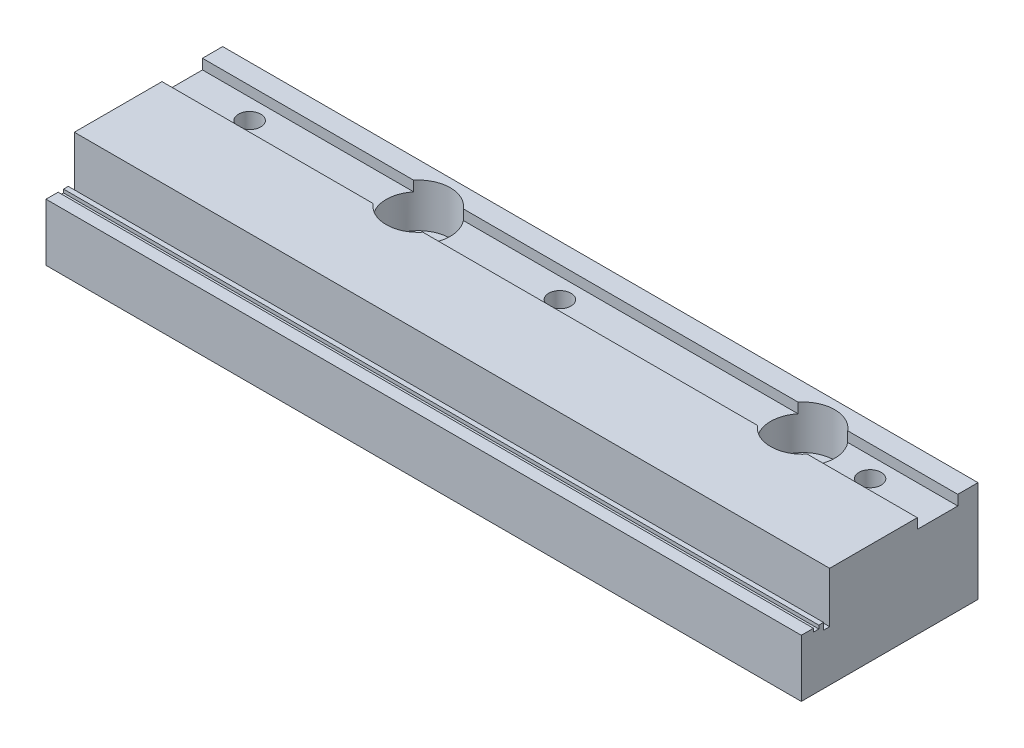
SolidWorks part; units mm, degrees
ref_plane "前视基准面" through (0, 0, 0) normal (0, 0, 1) x (1, 0, 0)
ref_plane "上视基准面" through (0, 0, 0) normal (0, 1, 0) x (1, 0, 0)
ref_plane "右视基准面" through (0, 0, 0) normal (1, 0, 0) x (0, 0, -1)
sketch "草图1" plane through (0, 0, 0) normal (0, 0, 1) x (1, 0, 0)
  line L0 (0, 0) -> (112, 0)
  line L1 (0, 15) -> (112, 15)
  line L2 (112, 0) -> (112, 15)
  line L3 (0, 0) -> (0, 15)
extrude "凸台-拉伸1" add sketch "草图1" along normal blind 26.2
sketch "草图2" plane through (112, 0, 0) normal (1, 0, 0) x (0, 0, -1)
  line L0 (-26.2, 0) -> (-26.2, 8.5)
  line L1 (-22, 7.5) -> (-22, 15)
  line L2 (-26.2, 8.5) -> (-24.4, 8.5)
  line L3 (0, 0) -> (0, 15)
  line L4 (-26.2, 0) -> (0, 0)
  line L5 (-22, 15) -> (-9, 15)
  line L6 (-22.9, 7.5) -> (-22.9, 8.5)
  line L7 (-22.9, 7.5) -> (-22, 7.5)
  line L8 (-23.6, 8.5) -> (-23.6, 8)
  line L9 (-24.4, 8.5) -> (-24.4, 8)
  line L10 (-24.4, 8) -> (-23.6, 8)
  line L11 (-23.6, 8.5) -> (-22.9, 8.5)
  line L12 (-9, 13.5) -> (-9, 15)
  line L13 (-3, 13.5) -> (-3, 15)
  line L14 (-9, 13.5) -> (-3, 13.5)
  line L15 (-3, 15) -> (0, 15)
extrude "切除-拉伸1" cut sketch "草图2" against normal through all flip side to cut
sketch "草图3" plane through (0, 13.5, 0) normal (0, 1, 0) x (1, 0, 0)
  circle A0 centre (35, -6) radius 2.75
  circle A1 centre (92, -6) radius 2.75
  circle A2 centre (10, -6) radius 1.65
  circle A3 centre (56, -6) radius 1.65
  circle A4 centre (102, -6) radius 1.65
extrude "切除-拉伸2" cut sketch "草图3" against normal blind 26.2
sketch "草图5" plane through (0, 15, 0) normal (0, 1, 0) x (1, 0, 0)
  circle A0 centre (35, -6) radius 4.75
  circle A1 centre (92, -6) radius 4.75
extrude "切除-拉伸3" cut sketch "草图5" against normal blind 6.5
